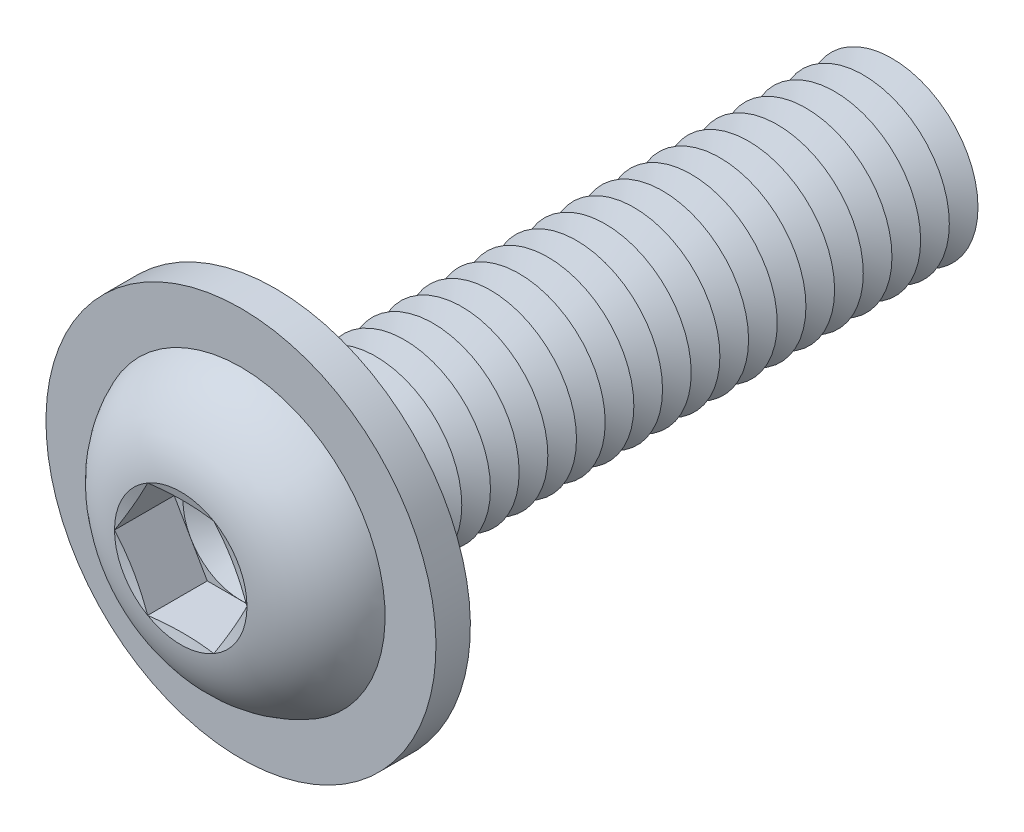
SolidWorks part; units mm, degrees
ref_plane "Front Plane" through (0, 0, 0) normal (0, 0, 1) x (1, 0, 0)
ref_plane "Top Plane" through (0, 0, 0) normal (0, 1, 0) x (1, 0, 0)
ref_plane "Right Plane" through (0, 0, 0) normal (1, 0, 0) x (0, 0, -1)
sketch "Sketch1" plane through (0, 0, 0) normal (1, 0, 0) x (0, 0, -1)
  line L0 (0, 3) -> (0, 5.25)
  line L3 (0, 3) -> (22, 3)
  line L4 (22, 3) -> (22, 0)
  line L5 (22, 0) -> (-3.3, 0) construction
  line L6 (-3.3, 0) -> (22, 0)
  line L7 (-3.3, 2.3094) -> (-3.3, 1.1547) construction
  line L8 (-3.3, 1.1547) -> (-3.3, 0)
  line L9 (-3.3, 2.3094) -> (-2.9906, 1.1547)
  line L10 (-2.9906, 1.1547) -> (-3.3, 1.1547)
  line L11 (22, 0) -> (22.7481, 0) construction
  line L12 (0, 5.25) -> (-3.3, 5.25) construction
  arc A1 (0, 5.25) -> (-3.3, 2.3094) centre (0, 1.928) ccw
  point P8 (22, 1.5)
  dimension "D1" = 10.5
  dimension "D2" = 6
  dimension "D3" = 3.3
  dimension "D4" = 4.6188
  dimension "D5" = 22
  dimension "D6" = 15
revolve "Revolve1" add sketch "Sketch1" angle 360 about L5
fillet "Fillet1" radius 0.5 1 edges at (-3, 0, 0)
sketch "Sketch2" plane through (0, 0, 0) normal (1, 0, 0) x (0, 0, -1)
  line L0 (21.5, 3) -> (22.5, 3)
  line L1 (22, 3) -> (0.5, 3) construction
  line L2 (22.5, 3) -> (22, 2.134)
  line L3 (22, -3) -> (22, 3) construction
  line L4 (22, 2.134) -> (21.5, 3)
  dimension "D1" = 1
revolve "Cut-Revolve1" cut sketch "Sketch2" angle 360 about axis through (0, 0, -22) along (0, 0, -1)
pattern_linear "LPattern1" count 22 spacing 1 along (0, 0, 1) of "Cut-Revolve1"
sketch "Sketch3" plane through (0, 0, 3.3) normal (0, 0, 1) x (1, 0, 0)
  line L7 (1.1547, 2) -> (-1.1547, 2)
  line L8 (-1.1547, 2) -> (-2.3094, 0)
  line L9 (-2.3094, 0) -> (-1.1547, -2)
  line L10 (-1.1547, -2) -> (1.1547, -2)
  line L11 (1.1547, -2) -> (2.3094, 0)
  line L12 (2.3094, 0) -> (1.1547, 2)
  circle A0 centre (0, 0) radius 2 construction
  circle A3 centre (0, 0) radius 2.3094 construction
extrude "Cut-Extrude1" cut sketch "Sketch3" against normal blind 2.08
sketch "Sketch4" plane through (0, 0, 1.22) normal (0, 0, 1) x (1, 0, 0)
  line L1 (1.1547, 2) -> (-1.1547, 2) construction
  circle A0 centre (0, 0) radius 2
extrude "Cut-Extrude2" cut sketch "Sketch4" against normal through all draft 60
sketch "Sketch5" plane through (0, 0, 0) normal (0, 0, -1) x (-1, 0, 0)
  circle A0 centre (0, 0) radius 6.8
  circle A1 centre (0, 0) radius 3.5
  circle A2 centre (0, 0) radius 3.5 construction
  dimension "D1" = 13.6
extrude "Boss-Extrude1" add sketch "Sketch5" against normal blind 1.2
